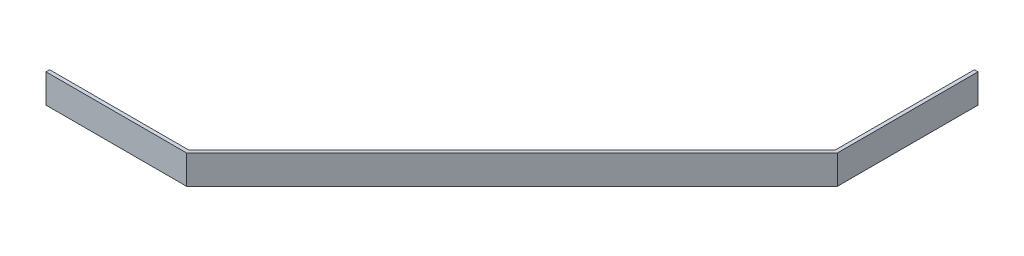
SolidWorks part; units mm, degrees
ref_plane "Front Plane" through (0, 0, 0) normal (0, 0, 1) x (1, 0, 0)
ref_plane "Top Plane" through (0, 0, 0) normal (0, 1, 0) x (1, 0, 0)
ref_plane "Right Plane" through (0, 0, 0) normal (1, 0, 0) x (0, 0, -1)
sketch "Sketch1" plane through (0, 0, 0) normal (0, 1, 0) x (1, 0, 0)
  line L0 (0, 0) -> (366.7125, 0)
  line L1 (366.7125, 0) -> (1219.2, 852.4875)
  line L2 (1219.2, 852.4875) -> (1219.2, 1219.2)
  line L3 (0, 0) -> (0, 1219.2) construction
  line L4 (0, 1219.2) -> (1219.2, 1219.2) construction
  line L5 (0, -9.525) -> (370.6579, -9.525)
  line L6 (370.6579, -9.525) -> (1228.725, 848.5421)
  line L7 (1228.725, 848.5421) -> (1228.725, 1219.2)
  line L8 (0, 0) -> (0, -9.525)
  line L9 (1219.2, 1219.2) -> (1228.725, 1219.2)
  point P10 (1596.862, 845.1474)
  dimension "D1" = 366.7125
  dimension "D2" = 1219.2
  dimension "D3" = 1219.2
  dimension "D4" = 9.525
extrude "Boss-Extrude1" add sketch "Sketch1" along normal blind 76.2
